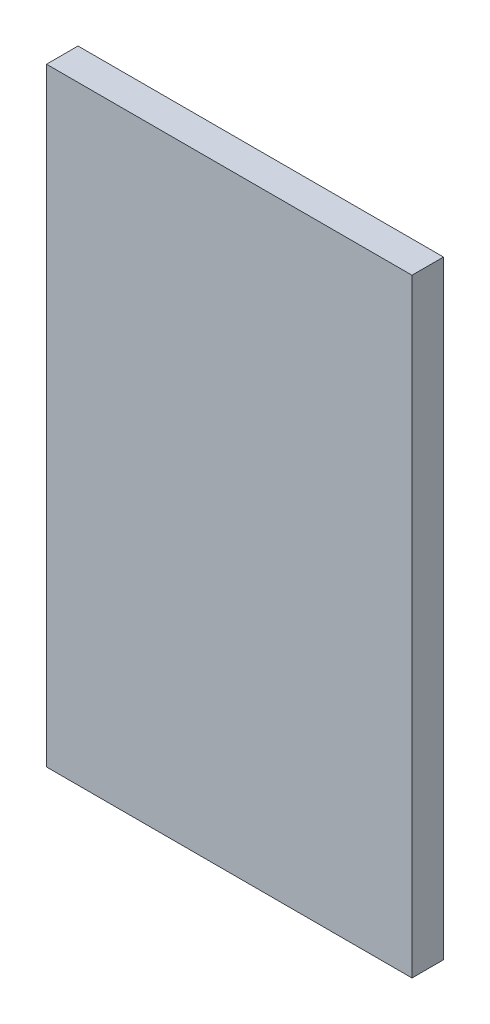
SolidWorks part; units mm, degrees
ref_plane "Plan de face" through (0, 0, 0) normal (0, 0, 1) x (1, 0, 0)
ref_plane "Plan de dessus" through (0, 0, 0) normal (0, 1, 0) x (1, 0, 0)
ref_plane "Plan de droite" through (0, 0, 0) normal (1, 0, 0) x (0, 0, -1)
sketch "Esquisse1" plane through (0, 0, 0) normal (0, 0, 1) x (1, 0, 0)
  line L1 (-59.15, 98.5) -> (59.15, 98.5)
  line L2 (-59.15, 98.5) -> (-59.15, -98.5)
  line L3 (-59.15, -98.5) -> (59.15, -98.5)
  line L4 (59.15, 98.5) -> (59.15, -98.5)
  line L5 (-59.15, 98.5) -> (59.15, -98.5) construction
  line L6 (-59.15, -98.5) -> (59.15, 98.5) construction
  point P0 (0, 0)
  dimension "D1" = 118.3
  dimension "D2" = 197
extrude "Boss.-Extru.1" add sketch "Esquisse1" along normal mid plane 10.2
